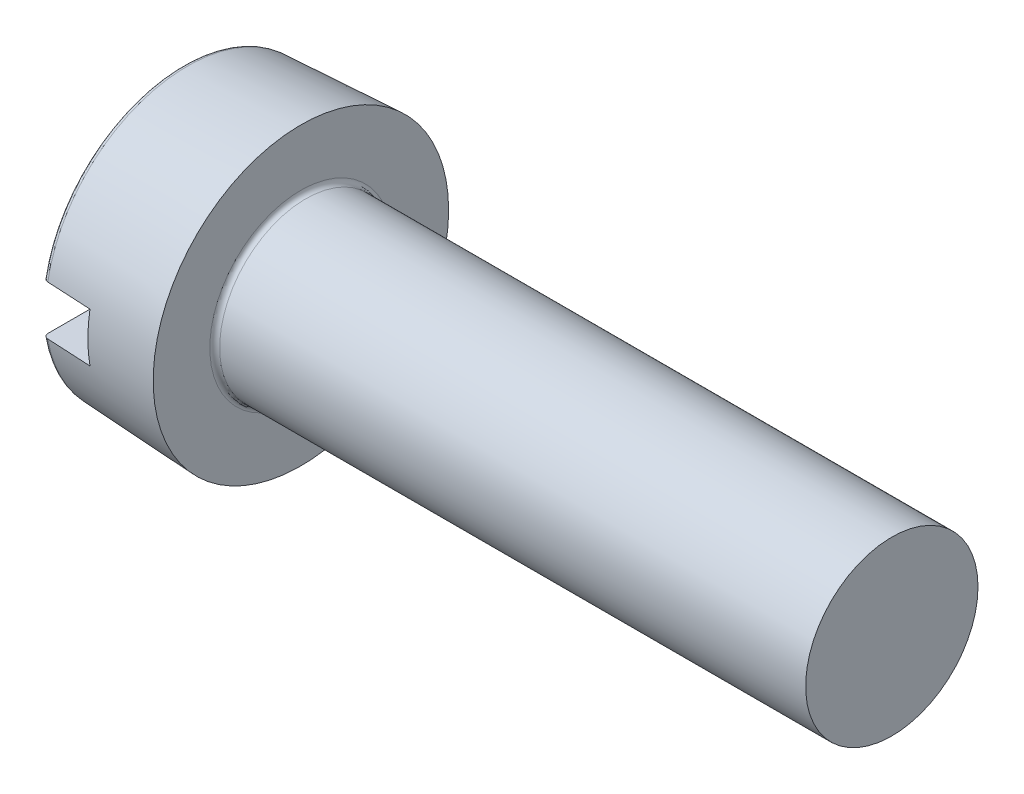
SolidWorks part; units mm, degrees
ref_plane "Front" through (0, 0, 0) normal (0, 0, 1) x (1, 0, 0)
ref_plane "Top" through (0, 0, 0) normal (0, 1, 0) x (1, 0, 0)
ref_plane "Right" through (0, 0, 0) normal (1, 0, 0) x (0, 0, -1)
other "Configuration Table"
ref_plane "Plane1" through (2.4, 0, 0) normal (1, 0, 0) x (0, 0, -1)
sketch "Sketch2" plane through (2.4, 0, 0) normal (1, 0, 0) x (0, 0, -1)
  circle A0 centre (0, 0) radius 3
  dimension "dk" = 6
extrude "BaseHead" add sketch "Sketch2" against normal blind 2.4 draft 3
sketch "Sketch3" plane through (2.4, -1.1101, -1.3544) normal (1, 0, 0) x (0, 0, -1)
  line L0 (-1.3544, 1.1101) -> (-0.1544, 1.1101) construction
  circle A0 centre (-1.3544, 1.1101) radius 1.75
  circle A1 centre (-1.3544, 1.1101) radius 3 construction
extrude "BaseBody" add sketch "Sketch3" along normal blind 12
sketch "Sketch4" plane through (-1.9, -1.9, 0) normal (0, 0, 1) x (0, 1, 0)
  line L1 (1.4, -1.9) -> (2.4, -1.9)
  line L2 (1.4, -1.9) -> (1.4, -2.9)
  line L3 (1.4, -2.9) -> (2.4, -2.9)
  line L4 (2.4, -1.9) -> (2.4, -2.9)
  line L5 (4.7742, -1.9) -> (-0.9742, -1.9) construction
extrude "Slot" cut sketch "Sketch4" against normal through all and the other way through all
fillet "HeadFillet" radius 0.1 3 edges at (2.4, 0, -1.75) (0, -2.8742, 0) (0, 2.8742, 0)
sketch "Sketch1" plane through (0, 0, 0) normal (0, 0, 1) x (1, 0, 0)
  line L0 (5.5483, 0) -> (-2.9147, 0) construction
  line L1 (2.4, 6.555) -> (-23.6, 6.555)
  line L2 (2.4, 6.555) -> (2.4, 1.555)
  line L3 (2.4, 1.555) -> (-25.1, 1.555)
  line L8 (-23.6, 1.75) -> (-25.1, 1.555)
  line L9 (-23.6, 6.555) -> (-23.6, 1.75)
  line L10 (2.4, -3) -> (2.4, 3) construction
  line L11 (14.4, -1.75) -> (14.4, 1.75) construction
  line L12 (14.4, 1.75) -> (2.5, 1.75) construction
  dimension "b1" = 3.11
  dimension "b" = 38
  dimension "x" = 1.5
  dimension "dd" = 5
sketch "Sketch5" plane through (0, 0, 0) normal (0, 0, 1) x (1, 0, 0)
  line L0 (14.5625, 1.75) -> (14.5625, 2.075)
  line L1 (14.5625, 2.075) -> (14.2375, 2.075)
  line L2 (14.2375, 2.075) -> (14.2375, 1.75)
  line L3 (14.2375, 1.75) -> (14.4, 1.4685)
  line L4 (14.4, 1.4685) -> (14.5625, 1.75)
  line L5 (14.4, -1.75) -> (14.4, 1.75) construction
  line L6 (0, 0) -> (15.9087, 0) construction
revolve "Cut-Revolve10" [suppressed] cut sketch "Sketch5" angle 360 about L6
pattern_linear "LPattern10" [suppressed] count 28 spacing 0.39 along (1, 0, 0)
equation "\"m@Sketch4\" = \"n@Sketch4\" / 2"
equation "\"D1@Plane1\"=\"k@BaseHead\""
equation "\"D1@Sketch5\" = \"d@Sketch3\""
equation "\"D2@Sketch5\" =  ( \"d@Sketch3\" - \"D2@ThreadCosmetic1\" )  / 2"
equation "\"D3@LPattern10\" = \"D2@Sketch5\" * 1.2"
equation "\"D1@LPattern10\" = \"D1@ThreadCosmetic1\" / \"D3@LPattern10\""
